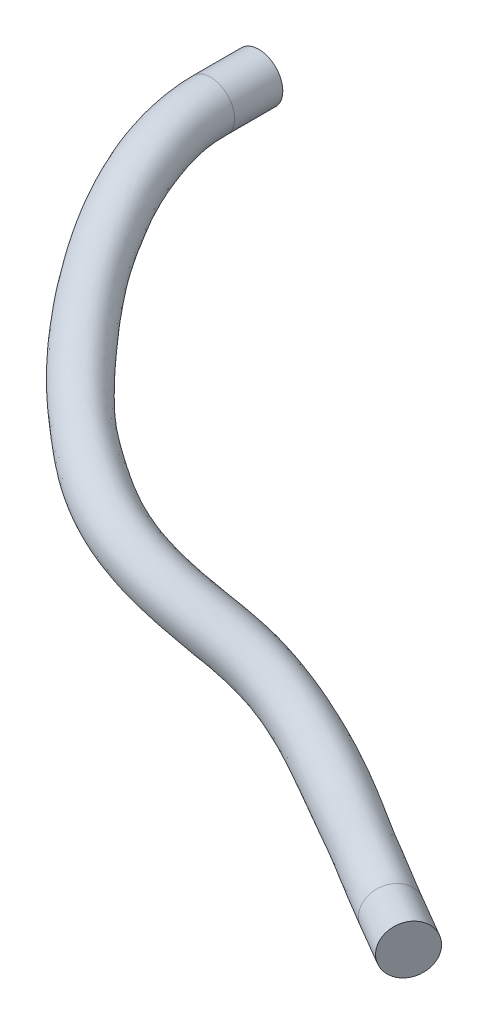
SolidWorks part; units mm, degrees
ref_plane "Front" through (0, 0, 0) normal (0, 0, 1) x (1, 0, 0)
ref_plane "Top" through (0, 0, 0) normal (0, 1, 0) x (1, 0, 0)
ref_plane "Right" through (0, 0, 0) normal (1, 0, 0) x (0, 0, -1)
sketch3d "3DSketch2"
  line L0 (0, 13.5636, 12.7) -> (0, 13.5636, 0)
  line L1 (140.2292, -64.8231, 100.7822) -> (129.2858, -64.9392, 94.3387)
  circle A0 centre (0, 13.5636, 0) radius 6.35 construction
  circle A3 centre (140.2292, -64.8231, 100.7822) radius 5.9055 construction
  spline_without_curve S0
  point P10 (145.3179, -64.7692, 103.7784)
  point P13 (0, 13.5636, 6.35)
  dimension "D1" = 12.7
  dimension "D2" = 12.7
sketch "Sketch2" plane through (0, 0, 0) normal (0, 0, 1) x (1, 0, 0)
  circle A0 centre (0, 13.5636) radius 6.35 construction
  circle A1 centre (0, 13.5636) radius 6.35
sweep "Base-Sweep" add profiles "Sketch2" path "3DSketch2"
